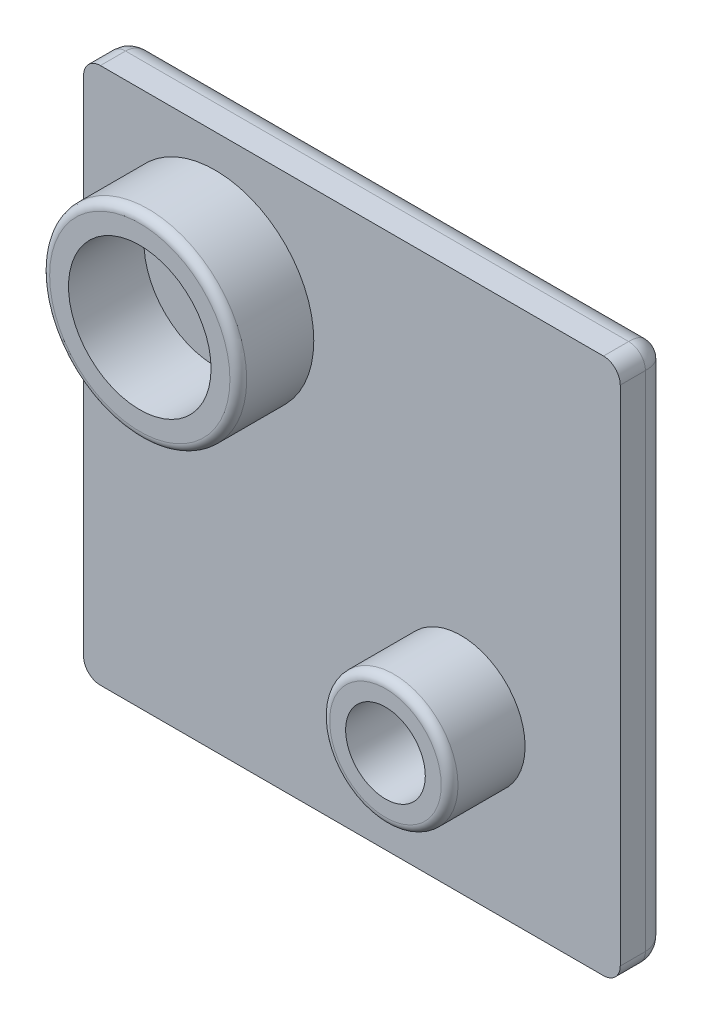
SolidWorks part; units mm, degrees
ref_plane "Front Plane" through (0, 0, 0) normal (0, 0, 1) x (1, 0, 0)
ref_plane "Top Plane" through (0, 0, 0) normal (0, 1, 0) x (1, 0, 0)
ref_plane "Right Plane" through (0, 0, 0) normal (1, 0, 0) x (0, 0, -1)
imported_body "Imported1"
sketch "Sketch1" plane through (0, 0, 0) normal (0, 0, -1) x (-1, 0, 0)
  circle A0 centre (0, 0) radius 2.375 construction
  circle A1 centre (0, 0) radius 2.375
extrude "Extrude1" cut sketch "Sketch1" against normal blind 10
